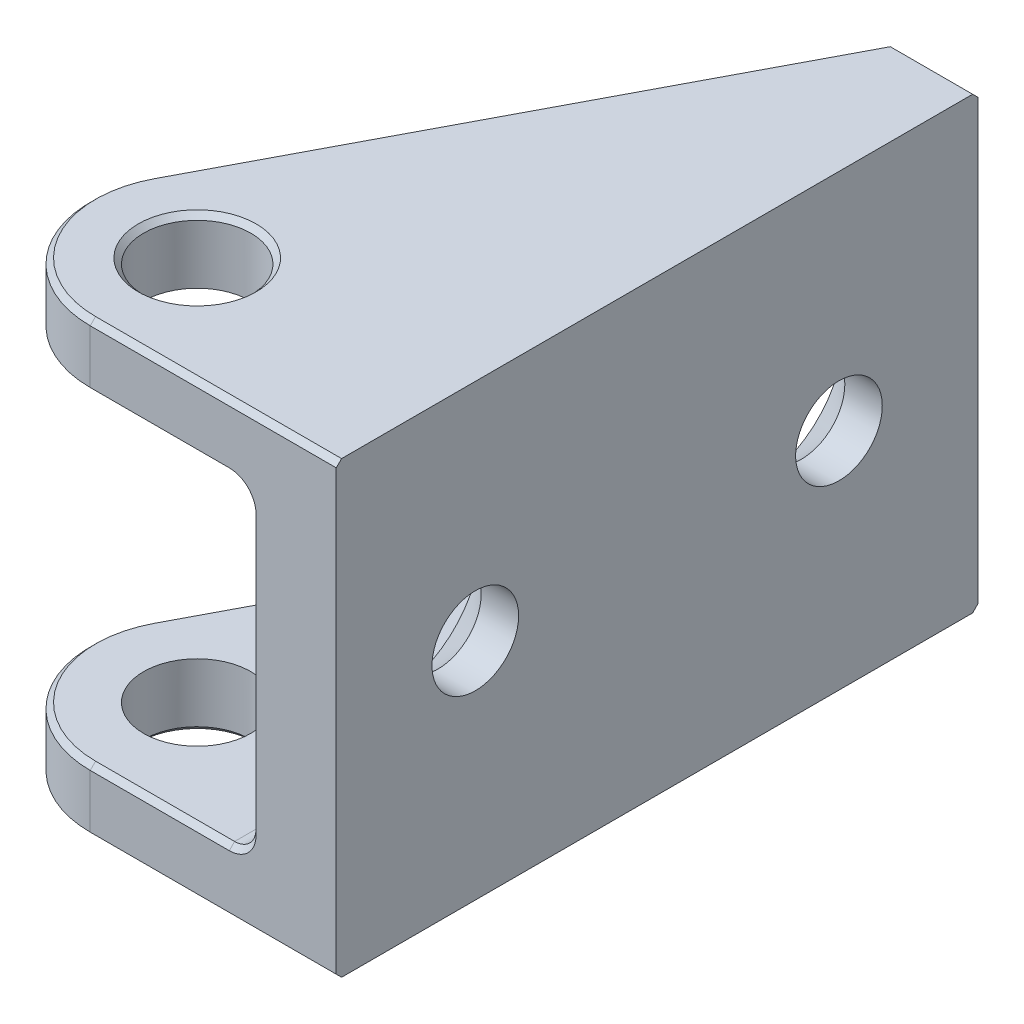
SolidWorks part; units mm, degrees
ref_plane "Front Plane" through (0, 0, 0) normal (0, 0, 1) x (1, 0, 0)
ref_plane "Top Plane" through (0, 0, 0) normal (0, 1, 0) x (1, 0, 0)
ref_plane "Right Plane" through (0, 0, 0) normal (1, 0, 0) x (0, 0, -1)
sketch "Sketch1" plane through (0, 0, 0) normal (0, 0, 1) x (1, 0, 0)
  line L0 (-25, 15) -> (0, 15)
  line L1 (0, 15) -> (0, -15)
  line L2 (0, -15) -> (-25, -15)
  line L3 (-25, -15) -> (-25, -21)
  line L4 (-25, -21) -> (8, -21)
  line L5 (8, -21) -> (8, 21)
  line L6 (8, 21) -> (-25, 21)
  line L7 (-25, 21) -> (-25, 15)
  point P7 (0, 0)
  dimension "D1" = 30
  dimension "D2" = 6
  dimension "D3" = 8
  dimension "D4" = 25
extrude "Boss-Extrude1" add sketch "Sketch1" along normal blind 60
sketch "Sketch2" plane through (0, 21, 0) normal (0, 1, 0) x (1, 0, 0)
  line L0 (0, -60) -> (0, 0) construction
  line L1 (0, -60) -> (0, 0) construction
  line L2 (0, 0) -> (-23.8504, -45.3449)
  line L5 (8, -60) -> (-25, -60) construction
  line L6 (-15, -60) -> (8, -60)
  line L7 (8, -60) -> (8, 0) construction
  line L8 (0, 0) -> (8, 0)
  line L9 (8, 0) -> (8, -60)
  line L10 (-25, -60) -> (-25, 0) construction
  arc A0 (-23.8504, -45.3449) -> (-15, -60) centre (-15, -50) ccw
  circle A2 centre (-15, -50) radius 5.01
  dimension "D1" = 10.02
  dimension "D2" = 10
extrude "Cut-Extrude1" cut sketch "Sketch2" against normal blind 80 flip side to cut
sketch "Sketch3" plane through (8, 0, 0) normal (1, 0, 0) x (0, 0, -1)
  line L0 (-47, 0) -> (-13, 0) construction
  line L1 (-13, 0) -> (0, 0) construction
  line L2 (0, -21) -> (0, 21) construction
  line L3 (-47, 0) -> (-60, 0) construction
  line L4 (-60, -21) -> (-60, 21) construction
  line L11 (-60, -21) -> (-60, 21) construction
  circle A0 centre (-13, 0) radius 4.05
  circle A1 centre (-47, 0) radius 4.05
  point P17 (-60, 0)
  dimension "D1" = 8.1
  dimension "D2" = 34
extrude "Cut-Extrude2" cut sketch "Sketch3" against normal blind 80
chamfer "Chamfer1" distance 4.5 angle 45 2 edges at (0, 4.05, 47) (0, 4.05, 13)
fillet "Fillet1" radius 2 2 edges at (0, -15, 30) (0, 15, 30)
chamfer "Chamfer2" distance 0.5 angle 45 26 edges at (0, 0, 0) (4, -21, 0) (-11.9252, -21, 22.6724) (-23.5601, -21, 55.1696) (-3.5, -21, 60) (4, 21, 0) (-11.9252, 21, 22.6724) (-23.5601, 21, 55.1696) (-3.5, 21, 60) (-0.5858, 14.4142, 1.1137) (-12.9252, 15, 24.5737) (-23.5601, 15, 55.1696) (-8.5, 15, 60) (-0.5858, 14.4142, 60) (0, 0, 60) (-0.5858, -14.4142, 60) (-8.5, -15, 60) (-23.5601, -15, 55.1696) (-0.5858, -14.4142, 1.1137) (-12.9252, -15, 24.5737) (8, 0, 60) (8, -21, 30) (8, 0, 0) (8, 21, 30) (-20.01, 21, 50) (-15, -21, 55.01)
